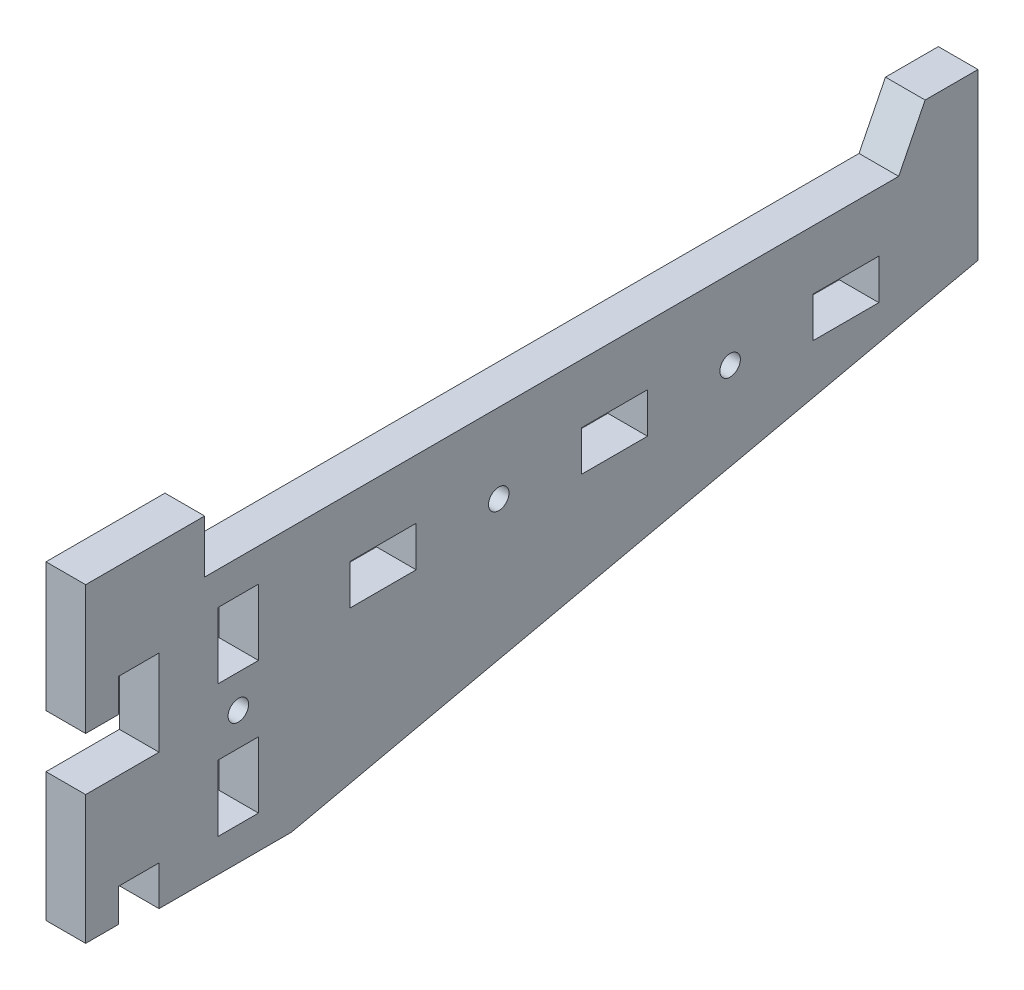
SolidWorks part; units mm, degrees
ref_plane "Спереди" through (0, 0, 0) normal (0, 0, 1) x (1, 0, 0)
ref_plane "Сверху" through (0, 0, 0) normal (0, 1, 0) x (1, 0, 0)
ref_plane "Справа" through (0, 0, 0) normal (1, 0, 0) x (0, 0, -1)
sketch "Эскиз1" plane through (0, 0, 0) normal (1, 0, 0) x (0, 0, -1)
  line L0 (0, 69.2083) -> (0, 0) construction
  line L1 (0, 0) -> (148.2467, 0) construction
  line L2 (111.9, 0) -> (115.9, 8)
  line L3 (115.9, 8) -> (123.9, 8)
  line L4 (123.9, 8) -> (123.9, -17)
  line L5 (0, -40) -> (20, -40)
  line L6 (0, -40) -> (0, -34)
  line L7 (0, -34) -> (-6.1, -34)
  line L8 (-6.1, -34) -> (-6.1, -39)
  line L9 (-6.1, -39) -> (-11.1, -39)
  line L10 (-11.1, -39) -> (-11.1, -19.5)
  line L11 (-11.1, -19.5) -> (0, -19.5)
  line L12 (0, -19.5) -> (0, -6.5)
  line L13 (0, -6.5) -> (-6.1, -6.5)
  line L14 (-6.1, -6.5) -> (-6.1, -11.5)
  line L15 (-6.1, -11.5) -> (-11.1, -11.5)
  line L16 (-11.1, -11.5) -> (-11.1, 8)
  line L17 (-11.1, 8) -> (6.9, 8)
  line L18 (6.9, 8) -> (6.9, 0)
  line L19 (6.9, 0) -> (111.9, 0)
  line L20 (20, -40) -> (123.9, -17)
  dimension "D1" = 8
  dimension "D2" = 25
  dimension "D3" = 105
  dimension "D4" = 18
  dimension "D5" = 6.1
  dimension "D6" = 5
  dimension "D7" = 19.5
  dimension "D8" = 8
  dimension "D9" = 5
  dimension "D10" = 12
  dimension "D11" = 8
  dimension "D12" = 20
  dimension "D13" = 6
extrude "Бобышка-Вытянуть1" add sketch "Эскиз1" along normal blind 6
sketch "Эскиз2" plane through (6, 0, 0) normal (1, 0, 0) x (0, 0, -1)
  line L0 (12, 0) -> (12, -40) construction
  line L1 (111.9, 0) -> (6.9, 0) construction
  line L2 (0, -40) -> (20, -40) construction
  line L3 (12, -20) -> (60.8244, -20) construction
  line L4 (8.95, -5) -> (15.05, -5)
  line L5 (8.95, -5) -> (8.95, -15)
  line L6 (8.95, -15) -> (15.05, -15)
  line L7 (15.05, -5) -> (15.05, -15)
  line L8 (8.95, -35) -> (8.95, -25)
  line L9 (8.95, -35) -> (15.05, -35)
  line L10 (15.05, -35) -> (15.05, -25)
  line L11 (8.95, -25) -> (15.05, -25)
  circle A0 centre (12, -20) radius 1.55
  point P12 (12, -5)
  dimension "D5" = 3.1
  dimension "D1" = 10
  dimension "D2" = 6.1
  dimension "D3" = 12
  dimension "D4" = 10
extrude "Вырез-Вытянуть1" cut sketch "Эскиз2" against normal through all
sketch "Эскиз3" plane through (6, 0, 0) normal (1, 0, 0) x (0, 0, -1)
  line L0 (123.9, -12) -> (22.7787, -12) construction
  line L1 (123.9, -17) -> (123.9, 8) construction
  line L3 (28.9, -8.95) -> (38.9, -8.95)
  line L4 (28.9, -8.95) -> (28.9, -15.05)
  line L5 (38.9, -8.95) -> (38.9, -15.05)
  line L6 (28.9, -15.05) -> (38.9, -15.05)
  line L7 (123.9, 8) -> (115.9, 8) construction
  line L8 (63.9, -8.95) -> (73.9, -8.95)
  line L9 (63.9, -8.95) -> (63.9, -15.05)
  line L10 (63.9, -15.05) -> (73.9, -15.05)
  line L11 (73.9, -8.95) -> (73.9, -15.05)
  line L12 (98.9, -8.95) -> (108.9, -8.95)
  line L13 (98.9, -8.95) -> (98.9, -15.05)
  line L14 (98.9, -15.05) -> (108.9, -15.05)
  line L15 (108.9, -8.95) -> (108.9, -15.05)
  circle A0 centre (51.4, -12) radius 1.55
  circle A1 centre (86.4, -12) radius 1.55
  point P4 (38.9, -12)
  dimension "D7" = 35
  dimension "D9" = 3.1
  dimension "D1" = 10
  dimension "D2" = 6.1
  dimension "D3" = 20
  dimension "D5" = 15
  dimension "D6" = 25
  dimension "D8" = 12.5
  dimension "D4" = 3
extrude "Вырез-Вытянуть2" cut sketch "Эскиз3" against normal through all
